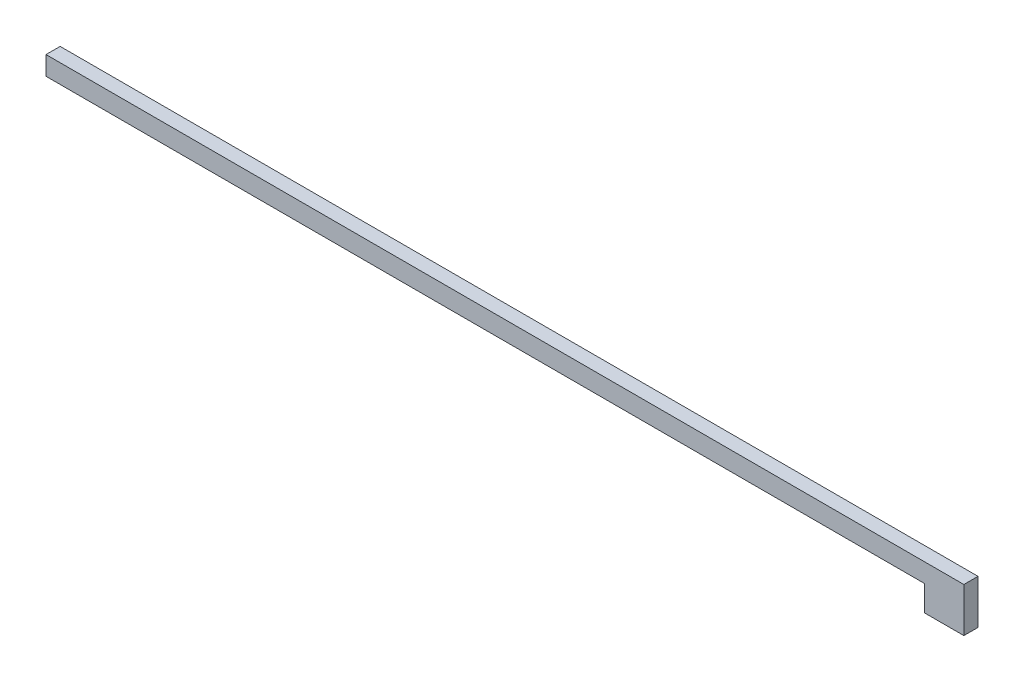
SolidWorks part; units mm, degrees
ref_plane "Front Plane" through (0, 0, 0) normal (0, 0, 1) x (1, 0, 0)
ref_plane "Top Plane" through (0, 0, 0) normal (0, 1, 0) x (1, 0, 0)
ref_plane "Right Plane" through (0, 0, 0) normal (1, 0, 0) x (0, 0, -1)
sketch "Sketch1" plane through (0, 0, 0) normal (0, 0, 1) x (1, 0, 0)
  line L0 (-122.6213, 19.3044) -> (114.1067, 19.3044)
  line L1 (-122.6213, 24.3844) -> (124.7747, 24.3844)
  line L2 (-122.6213, 24.3844) -> (-122.6213, 19.3044)
  line L3 (114.1067, 19.3044) -> (114.1067, 12.4464)
  line L4 (124.7747, 24.3844) -> (124.7747, 19.3044)
  line L5 (114.1067, 12.4464) -> (124.7747, 12.4464)
  line L6 (124.7747, 12.4464) -> (124.7747, 19.3044)
  dimension "D1" = 236.728
  dimension "D2" = 247.396
  dimension "D3" = 11.938
extrude "Extrude1" add sketch "Sketch1" along normal blind 3.81
